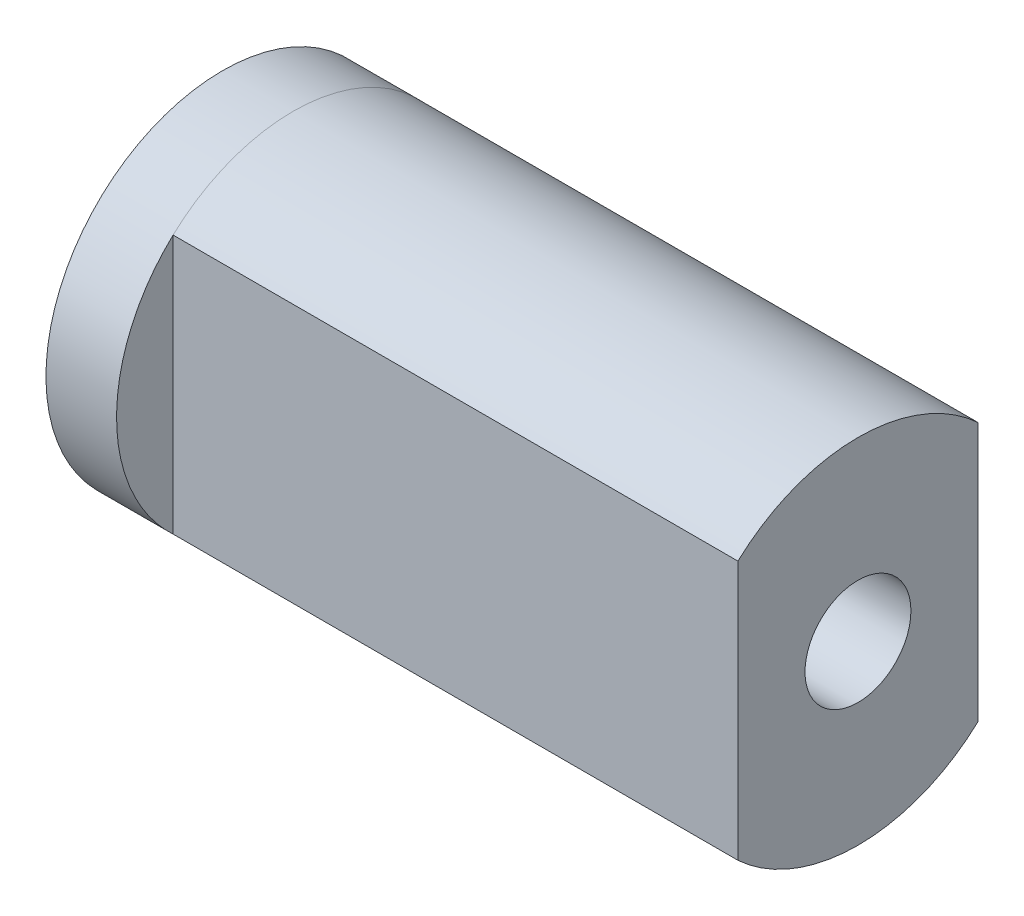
SolidWorks part; units mm, degrees
ref_plane "Alzado" through (0, 0, 0) normal (0, 0, 1) x (1, 0, 0)
ref_plane "Planta" through (0, 0, 0) normal (0, 1, 0) x (1, 0, 0)
ref_plane "Vista lateral" through (0, 0, 0) normal (1, 0, 0) x (0, 0, -1)
sketch "Croquis1" plane through (0, 0, 0) normal (1, 0, 0) x (0, 0, -1)
  circle A0 centre (0, 0) radius 2.5
  dimension "D1" = 5
extrude "Saliente-Extruir1" add sketch "Croquis1" along normal blind 1
sketch "Croquis2" plane through (1, 0, 0) normal (1, 0, 0) x (0, 0, -1)
  line L2 (-1.7, 1.835) -> (-1.7, -1.835)
  line L4 (1.7, 1.835) -> (1.7, -1.835)
  arc A0 (1.7, 1.835) -> (-1.7, 1.835) centre (0, 0) ccw
  arc A1 (-1.7, -1.835) -> (1.7, -1.835) centre (0, 0) ccw
  dimension "D3" = 5.0029
  dimension "D1" = 3.4
  dimension "D2" = 3.67
extrude "Saliente-Extruir2" add sketch "Croquis2" along normal blind 8
sketch "Croquis3" plane through (9, 0, 0) normal (1, 0, 0) x (0, 0, -1)
  circle A0 centre (0, 0) radius 0.75
  dimension "D1" = 1.5
extrude "Cortar-Extruir1" cut sketch "Croquis3" against normal blind 5
